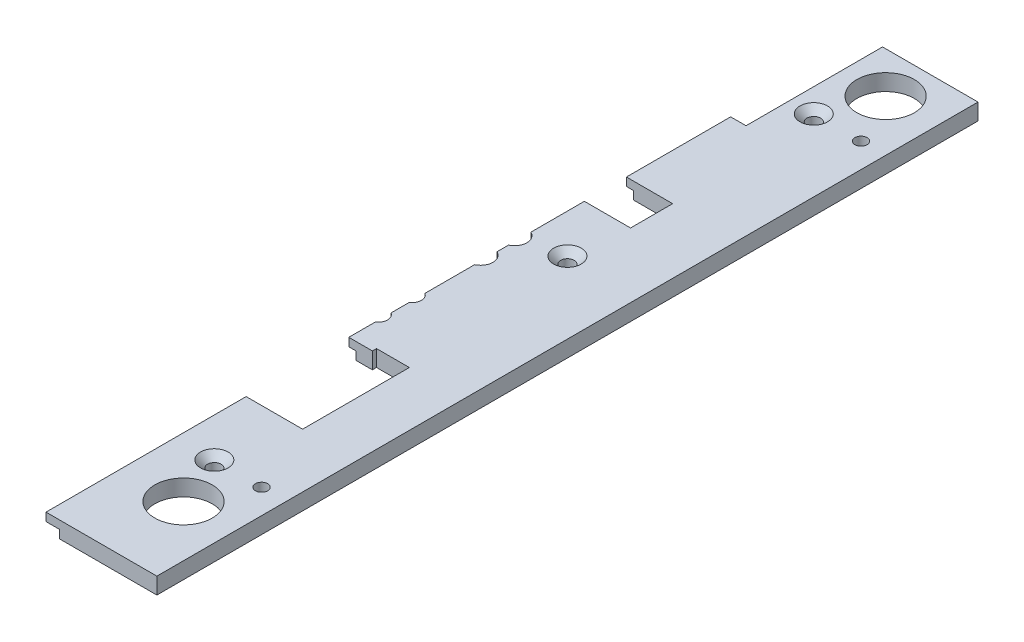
SolidWorks part; units mm, degrees
ref_plane "Frontal" through (0, 0, 0) normal (0, 0, 1) x (1, 0, 0)
ref_plane "Horizontal" through (0, 0, 0) normal (0, 1, 0) x (1, 0, 0)
ref_plane "Profil" through (0, 0, 0) normal (1, 0, 0) x (0, 0, -1)
mirrored part "Guide bande gauche_Rendre symétrique"
other "<Guide bande gauche>-<Enlèv. mat.-Extru.5>"
